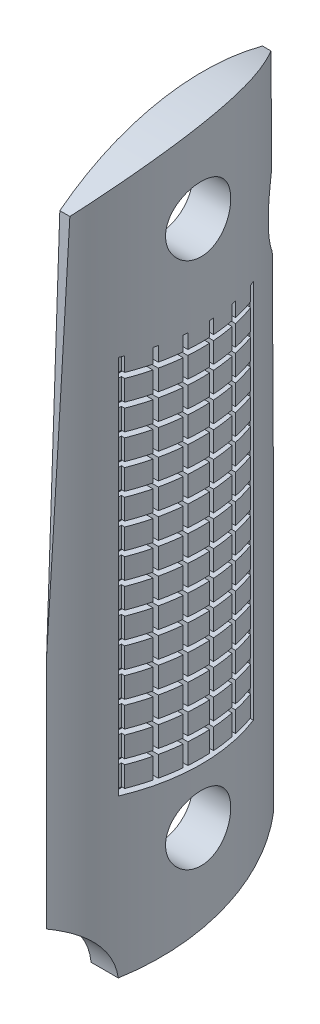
SolidWorks part; units mm, degrees
ref_plane "Front Plane" through (0, 0, 0) normal (0, 0, 1) x (1, 0, 0)
ref_plane "Top Plane" through (0, 0, 0) normal (0, 1, 0) x (1, 0, 0)
ref_plane "Right Plane" through (0, 0, 0) normal (1, 0, 0) x (0, 0, -1)
sketch "Sketch1" plane through (0, 0, 0) normal (1, 0, 0) x (0, 0, -1)
  line L0 (0, 0) -> (-30.3624, 0) construction
  line L1 (-10.2019, -15.1522) -> (17.9987, -9.158)
  line L2 (0, 0) -> (21.0094, 4.4657) construction
  line L3 (-14.8309, 83.524) -> (-17.9978, -7.403)
  line L4 (15.1694, 89.6348) -> (15.6125, 74.1644)
  line L5 (-44.2141, 90.7796) -> (38.5888, 90.7796) construction
  line L6 (15.924, 63.2861) -> (17.9987, -9.158)
  circle A0 centre (0, 0) radius 4.826
  circle A1 centre (0, 78.0796) radius 4.826
  arc A2 (-10.2019, -15.1522) -> (-17.9978, -7.403) centre (-18.796, -16.002) ccw
  arc A3 (15.6125, 74.1644) -> (15.924, 63.2861) centre (23.114, 68.9356) ccw
  arc A4 (15.4876, 78.5231) -> (12.6236, 87.0634) centre (0, 78.0796) ccw construction
  arc A5 (-14.0147, 83.4582) -> (-13.9781, 72.6064) centre (0, 78.0796) ccw construction
  arc A6 (15.1694, 89.6348) -> (-14.8309, 83.524) centre (6.35, 56.2356) ccw
  dimension "D2" = 9.652
  dimension "D7" = 17.272
  dimension "D5" = 16.002
  dimension "D6" = 30.988
  dimension "D1" = 18.796
  dimension "D10" = 23.114
  dimension "D12" = 18.288
  dimension "D3" = 12
  dimension "D4" = 12.7
  dimension "D8" = 12.7
  dimension "D9" = 6.35
  dimension "D11" = 9.144
extrude "Boss-Extrude1" add sketch "Sketch1" along normal blind 6.096
ref_plane "Plane1" through (0, 96.52, 0) normal (0, 1, 0) x (-1, 0, 0)
sketch "Sketch3" plane through (0, 96.52, 0) normal (0, 1, 0) x (-1, 0, 0)
  line L2 (0, -16.7871) -> (-21.5431, -16.7871)
  line L7 (-21.5431, -16.7871) -> (-21.5431, 16.7871)
  line L8 (-21.5431, 16.7871) -> (0, 16.7871)
  arc A0 (0, 16.7871) -> (0, -16.7871) centre (20.066, 0) ccw
  dimension "D1" = 52.324
extrude "Cut-Extrude2" cut sketch "Sketch3" against normal blind 131.318
ref_plane "Plane2" through (12.7, 0, 0) normal (1, 0, 0) x (0, 0, -1)
sketch "Sketch4" plane through (12.7, 0, 0) normal (1, 0, 0) x (0, 0, -1)
  line L0 (-9.5296, 64.4075) -> (-9.5296, 8.1755)
  line L1 (-9.5296, 8.1755) -> (-10.16, 8.1755)
  line L9 (-10.16, 64.4075) -> (-10.16, 8.1755)
  line L17 (-10.16, 64.4075) -> (-9.5296, 64.4075)
extrude "Cut-Extrude3" cut sketch "Sketch4" against normal blind 8.89
sketch "Sketch5" plane through (0, 0, 0) normal (1, 0, 0) x (0, 0, -1)
  line L0 (0, 0) -> (46.8542, 0) construction
pattern_linear "LPattern1" count 6 spacing 3.81 along (0, 0, -1) of "Cut-Extrude3"
sketch "Sketch6" plane through (0, 0, 0) normal (1, 0, 0) x (0, 0, -1)
  line L0 (-10.16, 8.1755) -> (9.5204, 8.1755)
  line L1 (9.5204, 8.1755) -> (9.5204, 8.9375)
  line L2 (9.5204, 8.1755) -> (9.5204, 64.4075) construction
  line L3 (9.5204, 8.9375) -> (-10.16, 8.9375)
  line L4 (-10.16, 64.4075) -> (-10.16, 8.1755) construction
  line L5 (-10.16, 8.9375) -> (-10.16, 8.1755)
  dimension "D1" = 0.762
extrude "Cut-Extrude4" cut sketch "Sketch6" along normal blind 8.89 from offset 3.175
pattern_linear "LPattern2" count 15 spacing 3.81 along (0, 1, 0) of "Cut-Extrude4"
